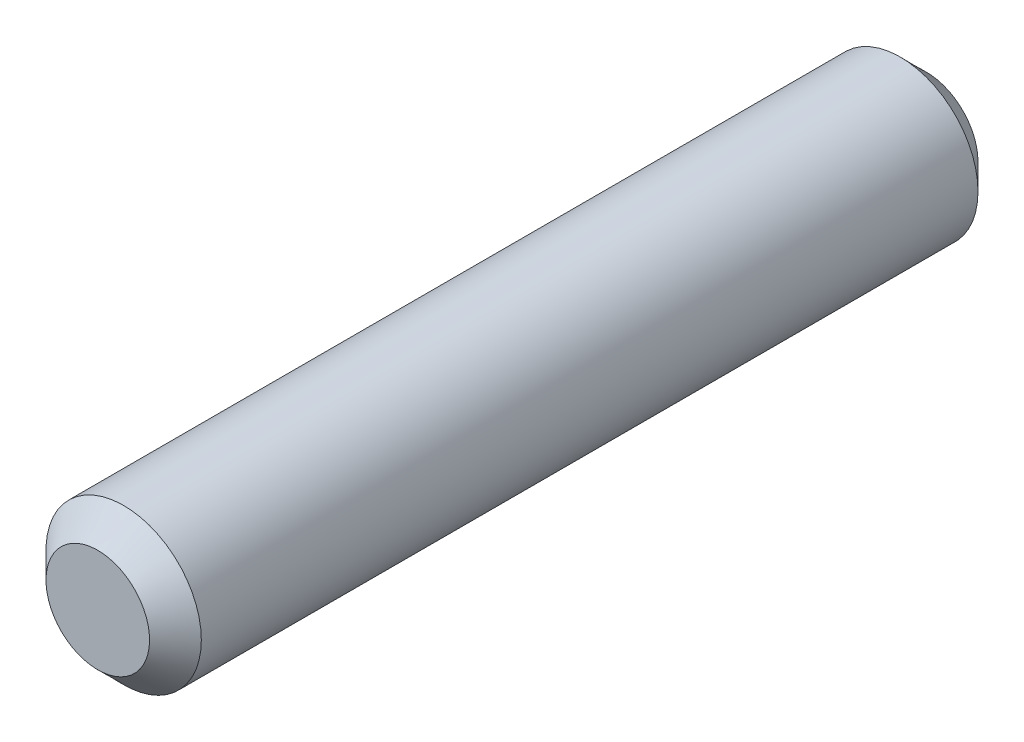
SolidWorks part; units mm, degrees
ref_plane "Plan de face" through (0, 0, 0) normal (0, 0, 1) x (1, 0, 0)
ref_plane "Plan de dessus" through (0, 0, 0) normal (0, 1, 0) x (1, 0, 0)
ref_plane "Plan de droite" through (0, 0, 0) normal (1, 0, 0) x (0, 0, -1)
sketch "Esquisse1" plane through (0, 0, 0) normal (0, 0, 1) x (1, 0, 0)
  circle A0 centre (0, 0) radius 1.5
  dimension "D1" = 3
extrude "Boss.-Extru.1" add sketch "Esquisse1" along normal mid plane 16
chamfer "Chanfrein1" distance 0.5 angle 45 2 edges at (1.5, 0, -8) (1.5, 0, 8)
